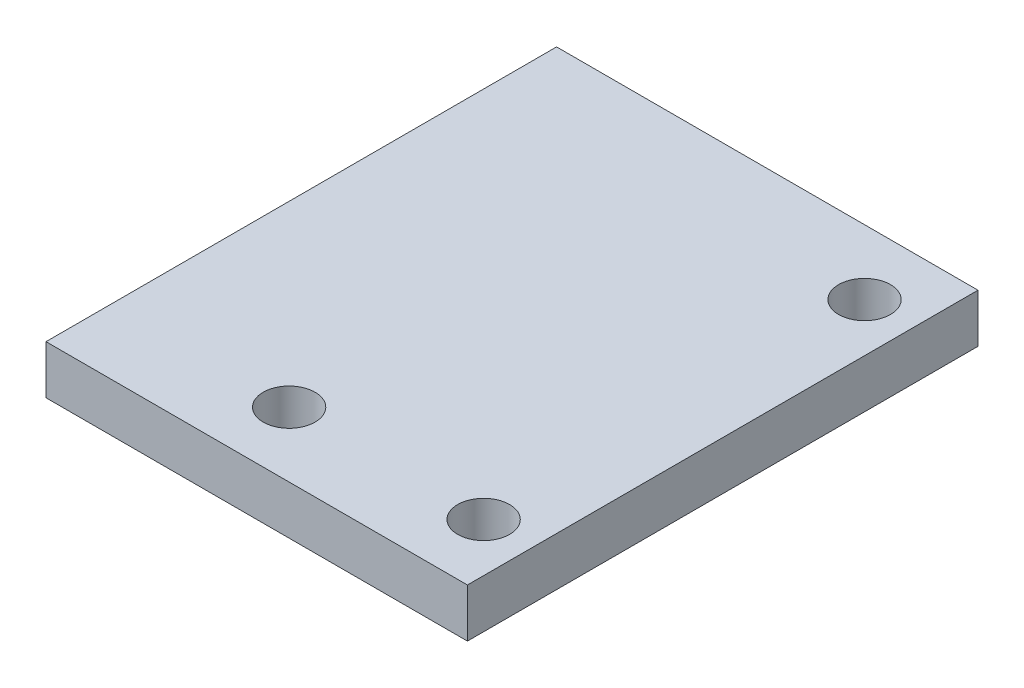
SolidWorks part; units mm, degrees
ref_plane "Front Plane" through (0, 0, 0) normal (0, 0, 1) x (1, 0, 0)
ref_plane "Top Plane" through (0, 0, 0) normal (0, 1, 0) x (1, 0, 0)
ref_plane "Right Plane" through (0, 0, 0) normal (1, 0, 0) x (0, 0, -1)
sketch "Sketch1" plane through (0, 0, 0) normal (0, 1, 0) x (1, 0, 0)
  line L0 (0, 12.0975) -> (0, -11.4025)
  line L1 (0, -11.4025) -> (-12, -11.4025)
  line L3 (3, -15.4025) -> (-23, -15.4025)
  line L4 (3, -15.4025) -> (3, 16.0975)
  line L5 (3, 16.0975) -> (-23, 16.0975)
  line L6 (-23, -15.4025) -> (-23, 16.0975)
  circle A0 centre (0, 12.0975) radius 1.6
  circle A1 centre (0, -11.4025) radius 1.6
  circle A2 centre (-12, -11.4025) radius 1.6
  dimension "D3" = 3.2
  dimension "D4" = 3.2
  dimension "D5" = 3.2
  dimension "D6" = 3
  dimension "D1" = 23.5
  dimension "D2" = 12
  dimension "D7" = 4
  dimension "D8" = 4
  dimension "D9" = 26
extrude "Boss-Extrude1" add sketch "Sketch1" along normal blind 3
